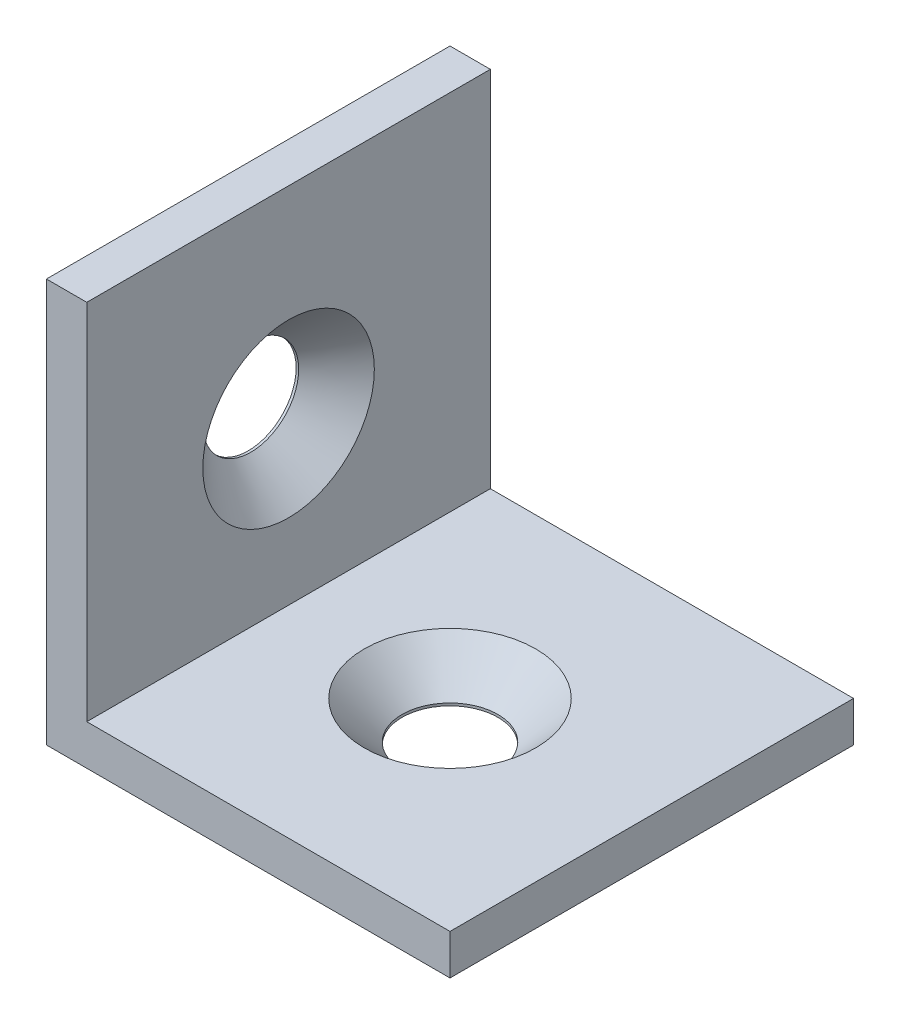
SolidWorks part; units mm, degrees
ref_plane "Alzado" through (0, 0, 0) normal (0, 0, 1) x (1, 0, 0)
ref_plane "Planta" through (0, 0, 0) normal (0, 1, 0) x (1, 0, 0)
ref_plane "Vista lateral" through (0, 0, 0) normal (1, 0, 0) x (0, 0, -1)
sketch "Croquis1" plane through (0, 0, 0) normal (0, 0, 1) x (1, 0, 0)
  line L0 (0, 0) -> (40, 0)
  line L1 (40, 0) -> (40, 4)
  line L2 (40, 4) -> (4, 4)
  line L3 (4, 4) -> (4, 40)
  line L4 (4, 40) -> (0, 40)
  line L5 (0, 40) -> (0, 0)
extrude "Extruir1" add sketch "Croquis1" along normal blind 40
sketch "Croquis2" plane through (0, 4, 0) normal (0, 1, 0) x (1, 0, 0)
  point P0 (20, -20)
sketch "Croquis3" plane through (4, 0, 0) normal (1, 0, 0) x (0, 0, -1)
  point P0 (-20, 20)
hole_wizard "Taladro1" positions "Croquis3D2" profile "Croquis5" legacy
sketch3d "Croquis3D2"
  point P0 (4, 20, 20)
  point P3 (20, 4, 20)
sketch "Croquis5" plane through (4, 20, 20) normal (0, 1, 0) x (0, 0, -1)
  line L0 (0, 0) -> (0, 4)
  line L1 (0, 4) -> (4.75, 4)
  line L2 (4.75, 4) -> (4.75, 3.75)
  line L3 (4.75, 3.75) -> (8.5, 0)
  line L5 (8.5, 0) -> (0, 0)
  line L6 (-4.75, 3.75) -> (-8.5, 0) construction
  line L11 (0, -6.35) -> (0, 107.95) construction
  dimension "Diámetro de taladro hasta el siguiente" = 9.5
  dimension "Profundidad de taladro hasta el siguiente" = 4
  dimension "Diámetro de avellanado cercano" = 17
  dimension "Ángulo de avellanado cercano" = 90
